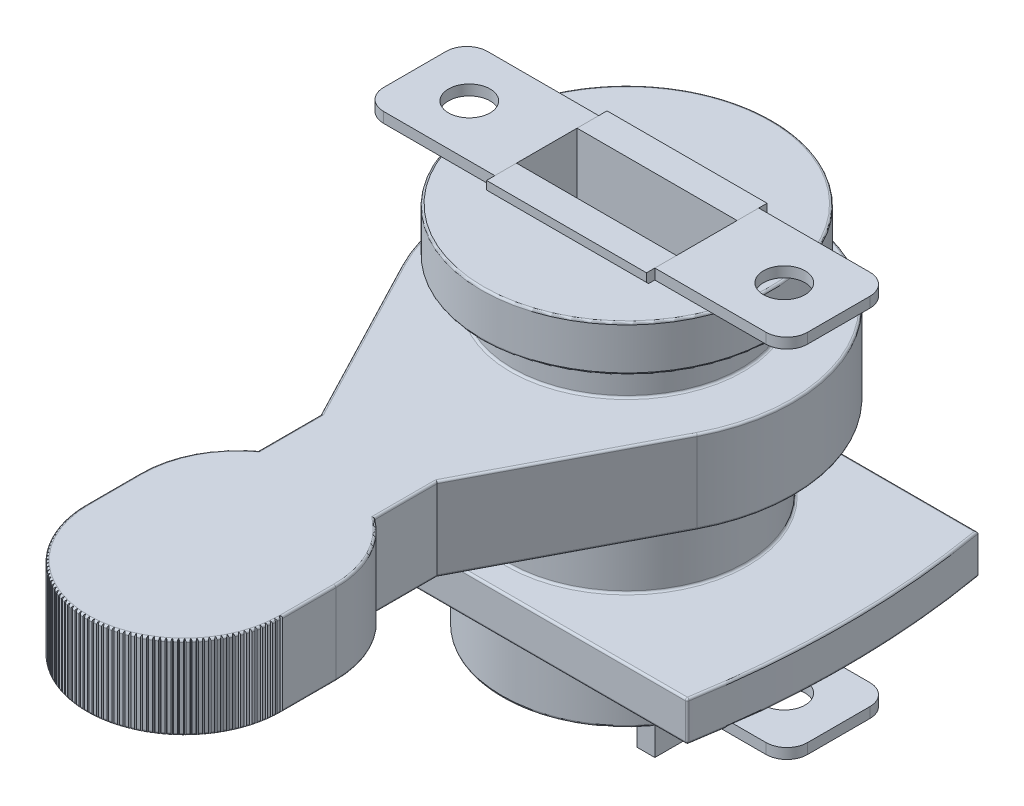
SolidWorks part; units mm, degrees
ref_plane "Płaszczyzna przednia" through (0, 0, 0) normal (0, 0, 1) x (1, 0, 0)
ref_plane "Płaszczyzna górna" through (0, 0, 0) normal (0, 1, 0) x (1, 0, 0)
ref_plane "Płaszczyzna prawa" through (0, 0, 0) normal (1, 0, 0) x (0, 0, -1)
sketch "Szkic1" plane through (0, 0, 0) normal (0, 1, 0) x (1, 0, 0)
  line L0 (0, 8) -> (0, -26) construction
  line L1 (0, -18.7) -> (0, -21.3) construction
  line L2 (4.7, -18.7) -> (4.7, -21.3)
  line L3 (-4.7, -18.7) -> (-4.7, -21.3)
  line L4 (-2.8, -11.9251) -> (-7.0921, -3.7016)
  line L6 (-2.8, -11.9251) -> (-2.8, -14.9251)
  line L8 (2.8, -11.9251) -> (2.8, -14.9251)
  line L11 (2.8, -11.9251) -> (7.0921, -3.7016)
  arc A0 (7.0921, -3.7016) -> (-7.0921, -3.7016) centre (0, 0) ccw
  arc A1 (4.7, -18.7) -> (2.8, -14.9251) centre (0, -18.7) ccw
  arc A2 (-4.7, -21.3) -> (4.7, -21.3) centre (0, -21.3) ccw
  arc A3 (-2.8, -14.9251) -> (-4.7, -18.7) centre (0, -18.7) ccw
  point P7 (0, -20)
  point P12 (0, -13.4251)
  dimension "D1" = 16
  dimension "D4" = 12
  dimension "D2" = 34
  dimension "D3" = 9.4
  dimension "D5" = 3
  dimension "D6" = 5.6
extrude "Dodanie-wyciągnięcie1" add sketch "Szkic1" along normal blind 4
sketch "Szkic2" plane through (0, 4, 0) normal (0, 1, 0) x (1, 0, 0)
  circle A0 centre (0, 0) radius 5.5
  dimension "D1" = 11
extrude "Dodanie-wyciągnięcie2" add sketch "Szkic2" along normal blind 2
sketch "Szkic3" plane through (0, 6, 0) normal (0, 1, 0) x (1, 0, 0)
  circle A0 centre (0, 0) radius 7
  dimension "D1" = 14
extrude "Dodanie-wyciągnięcie3" add sketch "Szkic3" along normal blind 2.2
sketch "Szkic4" plane through (0, 8.2, 0) normal (0, 1, 0) x (1, 0, 0)
  line L1 (-4.35, 2.5) -> (4.35, 2.5)
  line L2 (-4.35, 2.5) -> (-4.35, -2.5)
  line L3 (-4.35, -2.5) -> (4.35, -2.5)
  line L4 (4.35, 2.5) -> (4.35, -2.5)
  line L5 (-4.35, 2.5) -> (4.35, -2.5) construction
  line L6 (-4.35, -2.5) -> (4.35, 2.5) construction
  point P0 (0, 0)
  dimension "D1" = 8.7
  dimension "D2" = 5
extrude "Wytnij-wyciągnięcie1" cut sketch "Szkic4" against normal up to vertex
sketch "Szkic5" plane through (0, 0, 0) normal (0, 0, 1) x (1, 0, 0)
  line L0 (-10.2, 8.2) -> (-4.35, 8.2)
  line L1 (-4.35, 8.2) -> (-4.35, 4)
  line L2 (-4.35, 4) -> (0, 4)
  line L3 (4.7, 4) -> (-4.7, 4) construction
  line L4 (7, 8.2) -> (-7, 8.2) construction
  line L5 (-10.2, 8.7) -> (-3.85, 8.7)
  line L6 (-3.85, 8.7) -> (-3.85, 4.5)
  line L7 (-3.85, 4.5) -> (0, 4.5)
  line L8 (-10.2, 8.7) -> (-10.2, 8.2)
  line L9 (-7, 8.2) -> (-7, 6) construction
  line L10 (0, 4.5) -> (0, 4) construction
  line L11 (10.2, 8.7) -> (10.2, 8.2)
  line L12 (3.85, 4.5) -> (0, 4.5)
  line L13 (3.85, 8.7) -> (3.85, 4.5)
  line L14 (10.2, 8.7) -> (3.85, 8.7)
  line L15 (4.35, 4) -> (0, 4)
  line L16 (4.35, 8.2) -> (4.35, 4)
  line L17 (10.2, 8.2) -> (4.35, 8.2)
  dimension "D1" = 0.5
  dimension "D2" = 3.2
extrude "Dodanie-wyciągnięcie4" add sketch "Szkic5" against normal up to vertex and the other way up to vertex separate body
fillet "Zaokrąglenie1" radius 1 4 edges at (10.2, 8.45, -2.5) (10.2, 8.45, 2.5) (-10.2, 8.45, -2.5) (-10.2, 8.45, 2.5)
sketch "Szkic6" plane through (0, 8.7, 0) normal (0, 1, 0) x (1, 0, 0)
  line L0 (0, 2.5) -> (0, -2.5) construction
  line L1 (3.85, 2.5) -> (-3.85, 2.5) construction
  line L2 (-4.35, -2.5) -> (4.35, -2.5) construction
  circle A0 centre (-7.5779, 0) radius 1
  circle A1 centre (7.5779, 0) radius 1
  dimension "D1" = 2
extrude "Wytnij-wyciągnięcie2" cut sketch "Szkic6" against normal blind 3.6
sketch "Szkic7" plane through (0, 4.5, 0) normal (0, 1, 0) x (1, 0, 0)
  line L0 (3.85, 2.5) -> (3.85, -2.5) construction
  line L1 (-3.85, 2.5) -> (3.85, 2.5)
  line L2 (-3.85, 2.5) -> (-3.85, 1.4582)
  line L3 (-3.85, 1.4582) -> (3.85, 1.4582)
  line L4 (3.85, 2.5) -> (3.85, 1.4582)
extrude "Dodanie-wyciągnięcie5" add sketch "Szkic7" along normal up to vertex separate body
sketch "Szkic8" plane through (0, 0, -2.5) normal (0, 0, -1) x (-1, 0, 0)
  line L0 (-3.85, 8.7) -> (-3.85, 4.5) construction
  line L1 (3.85, 8.7) -> (-3.85, 8.7)
  line L2 (3.85, 8.7) -> (3.85, 8.2)
  line L3 (3.85, 8.2) -> (-3.85, 8.2)
  line L4 (-3.85, 8.7) -> (-3.85, 8.2)
  line L5 (-3.85, 8.7) -> (-3.85, 4.5) construction
extrude "Dodanie-wyciągnięcie6" add sketch "Szkic8" along normal blind 0.4
chamfer "Sfazowanie1" distance 0.1 angle 45 1 edges at (0, 8.2, -2.9)
mirror "Lustro1" about plane through (0, 0, 0) normal (0, 0, 1)
sketch "Szkic9" plane through (0, 0, 0) normal (0, -1, 0) x (1, 0, 0)
  circle A0 centre (0, 0) radius 5.7
  dimension "D1" = 11.4
extrude "Dodanie-wyciągnięcie7" add sketch "Szkic9" along normal blind 4
sketch "Szkic10" plane through (0, -4, 0) normal (0, -1, 0) x (1, 0, 0)
  line L0 (0, 7) -> (0, -7) construction
  line L1 (-9.9001, 7) -> (9.9001, 7)
  line L3 (-9.9001, -7) -> (9.9001, -7)
  line L5 (-9.9001, 7) -> (9.9001, -7) construction
  line L6 (-9.9001, -7) -> (9.9001, 7) construction
  arc A0 (-9.9001, 7) -> (-9.9001, -7) centre (30.6418, 0) ccw
  arc A1 (9.9001, 7) -> (9.9001, -7) centre (-30.6418, 0) cw
  point P0 (0, 0)
  dimension "D1" = 14
extrude "Dodanie-wyciągnięcie8" add sketch "Szkic10" along normal blind 1.9
sketch "Szkic11" plane through (0, -5.9, 0) normal (0, -1, 0) x (1, 0, 0)
  circle A0 centre (0, 0) radius 6
  dimension "D1" = 12
extrude "Dodanie-wyciągnięcie9" add sketch "Szkic11" along normal blind 2.5
sketch "Szkic12" plane through (0, -8.4, 0) normal (0, -1, 0) x (1, 0, 0)
  line L4 (-4.35, -2.5) -> (4.35, -2.5)
  line L5 (4.35, -2.5) -> (4.35, 2.5)
  line L6 (4.35, 2.5) -> (-4.35, 2.5)
  line L7 (-4.35, 2.5) -> (-4.35, -2.5)
  line L8 (-4.35, -2.5) -> (4.35, -2.5)
  line L9 (4.35, -2.5) -> (4.35, 2.5)
  line L10 (4.35, 2.5) -> (-4.35, 2.5)
  line L11 (-4.35, 2.5) -> (-4.35, -2.5)
  dimension "D1" = 0
extrude "Wytnij-wyciągnięcie3" cut sketch "Szkic12" against normal up to vertex
sketch "Szkic13" plane through (0, 0, 0) normal (0, 0, 1) x (1, 0, 0)
  line L0 (-10.2003, -8.4) -> (-4.35, -8.4)
  line L1 (-4.35, -8.4) -> (-4.35, 4)
  line L2 (-4.35, 4) -> (4.35, 4)
  line L3 (4.35, 4) -> (4.35, -8.4)
  line L4 (4.35, -8.4) -> (10.1996, -8.4)
  line L5 (-10.2003, -8.9) -> (-3.85, -8.9)
  line L6 (-3.85, -8.9) -> (-3.85, 3.5)
  line L7 (-3.85, 3.5) -> (3.85, 3.5)
  line L8 (3.85, 3.5) -> (3.85, -8.9)
  line L9 (3.85, -8.9) -> (10.1996, -8.9)
  line L10 (-10.2003, -8.4) -> (-10.2003, -8.9)
  line L11 (10.1996, -8.4) -> (10.1996, -8.9)
  dimension "D1" = 0.5
extrude "Dodanie-wyciągnięcie10" add sketch "Szkic13" along normal up to vertex and the other way up to vertex separate body
fillet "Zaokrąglenie2" radius 1 4 edges at (10.1996, -8.65, 2.5) (10.1996, -8.65, -2.5) (-10.2003, -8.65, -2.5) (-10.2003, -8.65, 2.5)
sketch "Szkic14" plane through (0, -8.9, 0) normal (0, -1, 0) x (1, 0, 0)
  circle A1 centre (7.5779, 0) radius 1
  circle A2 centre (7.5779, 0) radius 1
  circle A3 centre (-7.5779, 0) radius 1
  circle A4 centre (-7.5779, 0) radius 1
  dimension "D1" = 0
  dimension "D2" = 0
extrude "Wytnij-wyciągnięcie4" cut sketch "Szkic14" against normal blind 3.5
sketch "Szkic15" plane through (0, 3.5, 0) normal (0, -1, 0) x (1, 0, 0)
  line L5 (-3.85, -2.5) -> (3.85, -2.5) construction
  line L6 (3.85, 2.5) -> (2.9934, 2.5)
  line L7 (3.85, 2.5) -> (3.85, -2.5)
  line L8 (3.85, -2.5) -> (2.9934, -2.5)
  line L9 (2.9934, 2.5) -> (2.9934, -2.5)
extrude "Dodanie-wyciągnięcie11" add sketch "Szkic15" along normal blind 15.2 separate body
mirror "Lustro2" about plane through (0, 0, 0) normal (1, 0, 0)
sketch "Szkic16" plane through (0, -8.4, 0) normal (0, -1, 0) x (1, 0, 0)
  line L0 (-5.463, 2.4812) -> (-4.3398, 2.4831)
  line L1 (3.85, 2.5) -> (9.1996, 2.5) construction
  line L2 (5.4544, -2.5) -> (4.3301, -2.5)
  line L3 (3.85, -2.5) -> (9.1996, -2.5) construction
  line L4 (4.3312, 2.4981) -> (5.4544, 2.5)
  line L5 (-4.3301, -2.5) -> (-5.4544, -2.5)
  circle A0 centre (0, 0) radius 6 construction
  arc A1 (-5.4544, -2.5) -> (5.4544, -2.5) centre (0, 0) ccw
  arc A2 (-4.3301, -2.5) -> (4.3301, -2.5) centre (0, 0) ccw
  circle A3 centre (0, 0) radius 6 construction
  circle A4 centre (0, 0) radius 5 construction
  arc A5 (4.3312, 2.4981) -> (-4.3398, 2.4831) centre (0, 0) ccw
  arc A6 (5.4544, 2.5) -> (-5.463, 2.4812) centre (0, 0) ccw
  dimension "D1" = 1
extrude "Dodanie-wyciągnięcie12" add sketch "Szkic16" along normal blind 1
fillet "Zaokrąglenie3" radius 0.1 45 edges at (0, 6, 7) (0, 8.2, 7) (0, 6, 5.5) (5.4544, -8.9, 2.5) (-0.0104, -9.4, 6) (-5.463, -8.9, 2.4812) (-6, -8.4, -0.0104) (5.4544, -8.9, -2.5) (-5.4544, -8.9, -2.5) (0, -9.4, -6) (6, -8.4, 0) (-10.5, -4, 0) (0, -4, -7) (10.5, -4, 0) (0, -5.9, -7) (-10.5, -5.9, 0) (10.5, -5.9, 0) (0, -5.9, -6) (9.9001, -4.95, 7) (0, -5.9, 7) (-9.9001, -4.95, 7) (0, -4, 7) (0, -4, -5.7) (4.7, 4, 20) (0, 4, 26) (-4.7, 4, 20) (-4.1982, 4, 16.5869) (-2.8, 4, 13.4251) (-4.9461, 4, 7.8133) (0, 4, -8) (4.9461, 4, 7.8133) (2.8, 4, 13.4251) (4.1982, 4, 16.5869) (0, 4, 5.5) (2.8, 0, 13.4251) (4.9461, 0, 7.8133) (0, 0, -8) (-4.9461, 0, 7.8133) (-2.8, 0, 13.4251) (-4.1982, 0, 16.5869) (-4.7, 0, 20) (0, 0, 26) (4.7, 0, 20) (4.1982, 0, 16.5869) (0, 0, 5.7)
sketch "Szkic17" plane through (0, 4, 0) normal (0, 1, 0) x (1, 0, 0)
  line L0 (4.8929, -21.1741) -> (4.6, -21.3)
  line L1 (4.6, -21.3) -> (4.8929, -21.4348)
  line L2 (4.8929, -21.4348) -> (4.8929, -21.1741)
  arc A0 (-4.6, -21.3) -> (4.6, -21.3) centre (0, -21.3) ccw construction
  arc A1 (-4.6, -21.3) -> (4.6, -21.3) centre (0, -21.3) ccw construction
extrude "Wytnij-wyciągnięcie5" cut sketch "Szkic17" against normal blind 4.2
sketch "Szkic18" plane through (0, 4, 0) normal (0, 1, 0) x (1, 0, 0)
  arc A0 (-4.7, -21.3) -> (4.6998, -21.3459) centre (0, -21.3) ccw construction
  arc A1 (-4.7, -21.3) -> (4.6998, -21.3459) centre (0, -21.3) ccw
pattern_curve "CrvPattern2" of "Wytnij-wyciągnięcie5" parameters "D1"=70, "D3"=1, "D2"=1, "D4"=1
